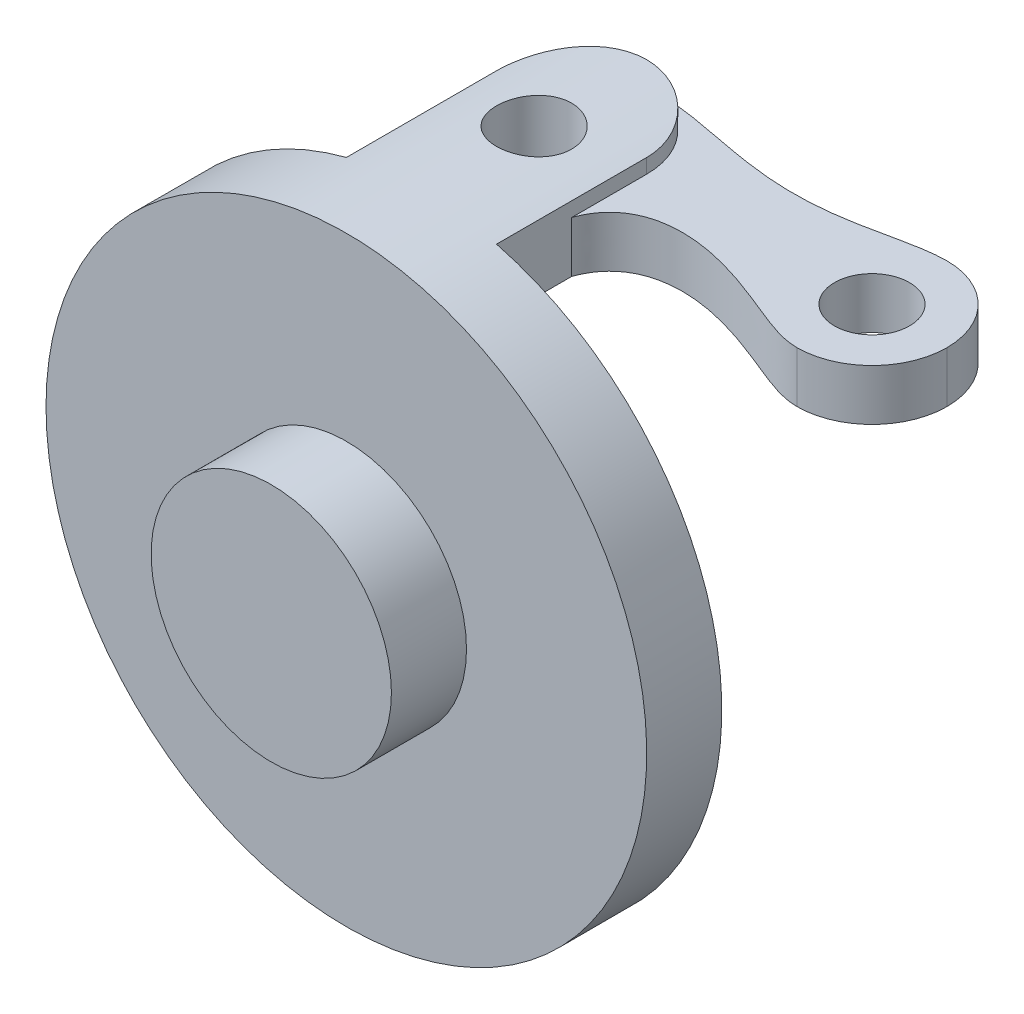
SolidWorks part; units mm, degrees
ref_plane "Front Plane" through (0, 0, 0) normal (0, 0, 1) x (1, 0, 0)
ref_plane "Top Plane" through (0, 0, 0) normal (0, 1, 0) x (1, 0, 0)
ref_plane "Right Plane" through (0, 0, 0) normal (1, 0, 0) x (0, 0, -1)
sketch "Sketch1" plane through (0, 0, 0) normal (0, 0, 1) x (1, 0, 0)
  circle A0 centre (0, 0) radius 80
extrude "Boss-Extrude1" add sketch "Sketch1" along normal blind 50
sketch "Sketch2" plane through (0, 0, 0) normal (0, 0, -1) x (-1, 0, 0)
  circle A0 centre (0, 0) radius 200
extrude "Boss-Extrude2" add sketch "Sketch2" along normal blind 50
sketch "Sketch3" plane through (0, 0, -50) normal (0, 0, -1) x (-1, 0, 0)
  line L0 (0, -200) -> (0, 200) construction
  line L6 (0, 0) -> (-59.0079, 0) construction
  line L12 (0, 150) -> (-50, 150)
  line L13 (-50, 150) -> (-50, 193.6492)
  line L14 (0, 150) -> (50, 150)
  line L15 (50, 150) -> (50, 193.6492)
  line L16 (50, -150) -> (50, -193.6492)
  line L17 (0, -150) -> (50, -150)
  line L18 (-50, -150) -> (-50, -193.6492)
  line L19 (0, -150) -> (-50, -150)
  circle A1 centre (0, 0) radius 200 construction
  arc A2 (50, 193.6492) -> (-50, 193.6492) centre (0, 0) ccw
  arc A3 (50, -193.6492) -> (-50, -193.6492) centre (0, 0) cw
  dimension "D1" = 150
  dimension "D2" = 50
  dimension "D3" = 50
extrude "Boss-Extrude4" add sketch "Sketch3" along normal blind 150
sketch "Sketch5" plane through (0, 150, 0) normal (0, -1, 0) x (1, 0, 0)
  line L0 (0, 0) -> (0, -125) construction
  circle A0 centre (0, -125) radius 25
extrude "Cut-Extrude2" cut sketch "Sketch5" against normal through all both and the other way through all
fillet "Fillet2" radius 50 4 edges at (-50, -171.8246, -200) (50, -171.8246, -200) (50, 171.8246, -200) (-50, 171.8246, -200)
sketch "Sketch6" plane through (0, 150, 0) normal (0, -1, 0) x (1, 0, 0)
  line L5 (-250, -150) -> (-200, -150) construction
  line L13 (250, -200) -> (200, -200)
  line L14 (250, -100) -> (250, -200)
  line L21 (200, -100) -> (250, -100)
  line L22 (200, -100) -> (172.9033, -100) construction
  line L23 (172.9033, -100) -> (145.8851, -125) construction
  line L24 (145.8851, -125) -> (101.6053, -136.0916) construction
  line L25 (101.6053, -136.0916) -> (79.6906, -132.7893) construction
  line L26 (79.6906, -132.7893) -> (58.6764, -125) construction
  line L27 (58.6764, -125) -> (50, -100) construction
  line L28 (50, -100) -> (0, -200)
  line L29 (200, -200) -> (173.0238, -200) construction
  line L30 (173.0238, -200) -> (144.183, -186.7587) construction
  line L31 (144.183, -186.7587) -> (116.7321, -183.1101) construction
  line L32 (116.7321, -183.1101) -> (76.9908, -181.9425) construction
  line L33 (76.9908, -181.9425) -> (44.3867, -203.397) construction
  line L34 (44.3867, -203.397) -> (0, -200) construction
  circle A1 centre (200, -150) radius 25
  spline_without_curve S2
  spline_without_curve S3
  dimension "D3" = 50
extrude "Boss-Extrude5" add sketch "Sketch6" against normal blind 34
fillet "Fillet3" radius 50 2 edges at (250, 167, -100) (250, 167, -200)
